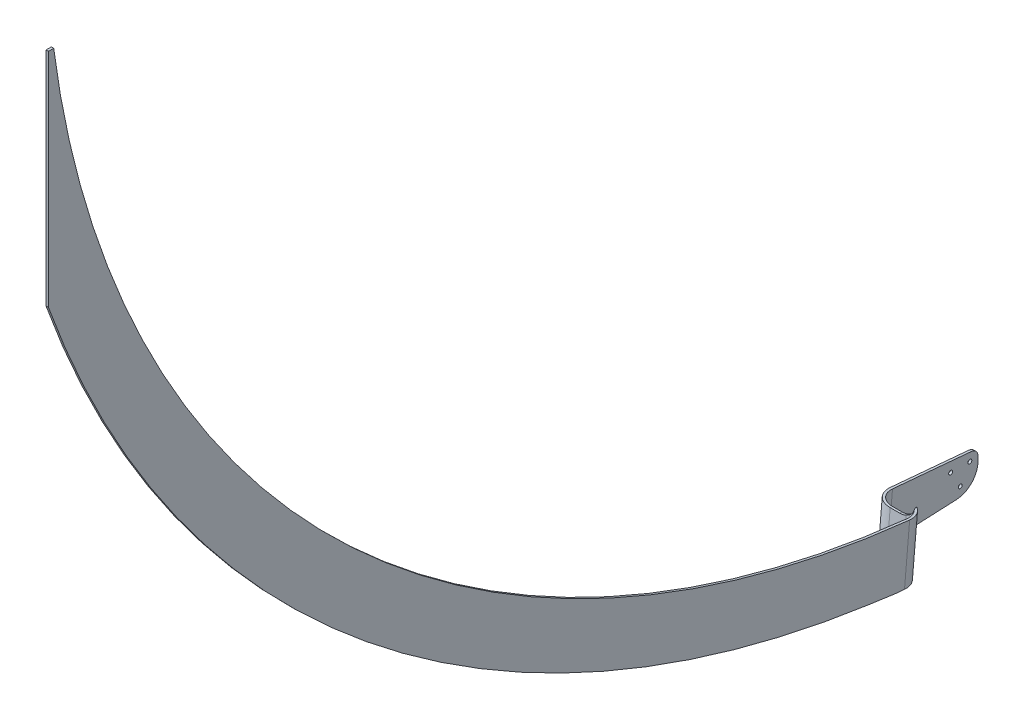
SolidWorks part; units mm, degrees
ref_plane "Front Plane" through (0, 0, 0) normal (1, 0, 0) x (0, 1, 0)
ref_plane "Top Plane" through (0, 0, 0) normal (0, 0, 1) x (0, 1, 0)
ref_plane "Right Plane" through (0, 0, 0) normal (0, 1, 0) x (-1, 0, 0)
sketch "sk Profile Rad Corner"
sketch_block_instance "Profile Rad Corner-1"
sketch_block "Profile Rad Corner"
sketch "Sketch2" plane through (0, 0, 0) normal (1, 0, 0) x (0, 1, 0)
  line L2 (2319.3675, 1853.7225) -> (1274.52, 1853.7225)
  line L3 (-80.9625, 498.24) -> (-80.9625, -463.1118)
  line L4 (2322.094, 1777.5225) -> (1274.52, 1777.5225)
  line L5 (-4.7625, 498.24) -> (-4.7625, -463.1118)
  line L6 (2319.3675, 1777.5225) -> (1274.52, 1777.5225)
  line L7 (-4.7625, 498.24) -> (-4.7625, -463.1118)
  line L8 (2319.3675, 1853.7225) -> (2319.3675, 1777.5225)
  line L9 (-4.7625, -463.1118) -> (-80.9625, -463.1118)
  arc A1 (1274.52, 1853.7225) -> (-80.9625, 498.24) centre (1274.52, 498.24) ccw
  arc A2 (1274.52, 1777.5225) -> (-4.7625, 498.24) centre (1274.52, 498.24) ccw
  arc A3 (1274.52, 1777.5225) -> (-4.7625, 498.24) centre (1274.52, 498.24) ccw
  dimension "D1" = 3.175
  dimension "D2" = 76.2
extrude "Boss-Extrude1" add sketch "Sketch2" along normal mid plane 3.175
sketch "Sketch3" plane through (0, 0, 0) normal (1, 0, 0) x (0, 1, 0)
  line L0 (-90.7135, 620.3852) -> (0.327, 612.24)
  line L1 (0.327, 612.24) -> (0.327, -654.8891)
  line L2 (0.327, -654.8891) -> (-90.7135, -654.8891)
  line L3 (-90.7135, -654.8891) -> (-90.7135, 620.3852)
  line L4 (-1.7425, 589.1085) -> (2.3966, 635.3715) construction
  line L5 (-63.1351, 758.0146) -> (-88.0045, 480.0461) construction
  arc A0 (1274.52, 1777.5225) -> (-4.7625, 498.24) centre (1274.52, 498.24) ccw construction
  arc A1 (1274.52, 1853.7225) -> (-80.9625, 498.24) centre (1274.52, 498.24) ccw construction
  point P7 (-75.5698, 619.0304)
  point P11 (0.327, 612.24)
  point P19 (-75.5698, 619.0304)
  dimension "D1" = 114
extrude "Cut-Extrude2" cut sketch "Sketch3" against normal through all both and the other way through all
ref_plane "Rib Tang 1" through (0, -129.9136, 11.6232) normal (0, -0.996, 0.0891) x (0, -0.0891, -0.996)
sketch "Sketch4" plane through (0, -129.9136, 11.6232) normal (0, -0.996, 0.0891) x (0, -0.0891, -0.996)
  line L24 (-677.4232, 1.5875) -> (-606.2482, 1.5875)
  line L25 (-606.2482, 1.5875) -> (-606.2482, -44.7675)
  line L26 (-584.0232, -66.9925) -> (-470.4232, -66.9925)
  line L27 (-677.4232, -1.5875) -> (-609.4232, -1.5875)
  line L28 (-609.4232, -1.5875) -> (-609.4232, -44.7675)
  line L29 (-584.0232, -70.1675) -> (-470.4232, -70.1675)
  line L30 (-677.4232, -1.5875) -> (-677.4232, 1.5875)
  line L31 (-470.4232, -66.9925) -> (-470.4232, -70.1675)
  line L32 (-609.8334, 1.5875) -> (-1959.9232, 1.5875) construction
  line L33 (-606.2482, 1.5875) -> (-606.2482, -66.9925) construction
  line L34 (-606.2482, -66.9925) -> (-470.4232, -66.9925) construction
  line L35 (-609.4232, -1.5875) -> (-609.4232, -70.1675) construction
  line L36 (-609.4232, -70.1675) -> (-470.4232, -70.1675) construction
  arc A12 (-606.2482, -44.7675) -> (-584.0232, -66.9925) centre (-584.0232, -44.7675) ccw
  arc A13 (-609.4232, -44.7675) -> (-584.0232, -70.1675) centre (-584.0232, -44.7675) ccw
  dimension "D1" = 3.175
  dimension "D6" = 25.4
  dimension "D5" = 22.225
  dimension "D3" = 207
  dimension "D4" = 68
  dimension "D2" = 68.58
extrude "Boss-Extrude2" add sketch "Sketch4" against normal blind 59
fillet "Fillet1" radius 22.225 1 edges at (-1.5875, -46.2237, 615.993)
fillet "Fillet2" radius 25.4 1 edges at (1.5875, -46.5067, 612.8306)
fillet "Fillet6" radius 12 1 edges at (-19.5621, -8.2388, 613.0064)
fillet "Fillet7" radius 22 1 edges at (-9.7343, -16.4903, 617.285)
sketch "Sketch5" plane through (0, 0, 0) normal (1, 0, 0) x (0, 1, 0)
  line L0 (-85.7484, 702.3647) -> (-66.0818, 698.9522)
  line L1 (-66.0818, 698.9522) -> (-77.7465, 615.6451)
  line L2 (-85.7484, 702.3647) -> (-77.7465, 615.6451)
  arc A0 (1274.52, 1853.7225) -> (-67.8672, 686.201) centre (1274.52, 498.24) ccw construction
extrude "Cut-Extrude3" cut sketch "Sketch5" against normal through all both and the other way through all
sketch "Sketch6" plane through (-66.9925, 0, 0) normal (1, 0, 0) x (0, 1, 0)
  point P0 (-38.9875, 485.7178)
  line B0 (-60.9845, 498.4178) -> (-38.9875, 511.1178) construction
  line B1 (-38.9875, 511.1178) -> (-38.9875, 485.7178) construction
  line B2 (-38.9875, 485.7178) -> (-60.9845, 498.4178) construction
  circle B3 centre (-60.9845, 498.4178) radius 2.5908
  circle B4 centre (-38.9875, 485.7178) radius 2.5908
  circle B5 centre (-38.9875, 511.1178) radius 2.5908
  line B6 (-49.986, 504.7678) -> (-46.3198, 498.4178) construction
sketch_block_instance "Blind Rivet holes-1"
sketch_block "Blind Rivet holes" parameters "D1"=5.1816, "D2"=5.1816, "D3"=5.1816, "D4"=60, "D5"=60, "D6"=25.4, "D7"=25.4, "D8"=25.4
extrude "Holes Tab 1" cut sketch "Sketch6" against normal through all both and the other way through all
sketch "Sketch7" plane through (-66.9925, 0, 0) normal (1, 0, 0) x (0, 1, 0)
  line L0 (-87.993, 480.1748) -> (-29.2277, 474.9171)
  line L1 (-29.2277, 474.9171) -> (-88.4634, 474.9171)
  line L2 (-87.993, 480.1748) -> (-77.8698, 593.3228) construction
  line L3 (-88.4634, 474.9171) -> (-87.993, 480.1748)
extrude "Boss-Extrude3" add sketch "Sketch7" against normal blind 3.175
fillet "Fillet9" radius 9.525 1 edges at (-68.58, -29.2277, 474.9171)
sketch "Sketch8" plane through (0, 0, 0) normal (1, 0, 0) x (0, 1, 0)
  line L0 (-77.8698, 593.3228) -> (-72.4634, 474.9171)
  line L1 (-77.8698, 593.3228) -> (-91.6494, 474.9171)
  line L2 (-91.6494, 474.9171) -> (-72.4634, 474.9171)
  line L3 (-88.4634, 474.9171) -> (-37.9386, 474.9171) construction
  dimension "D1" = 16
extrude "Cut-Extrude5" cut sketch "Sketch8" against normal through all both and the other way through all
fillet "Fillet11" radius 30 1 edges at (-68.58, -72.4634, 474.9171)
sketch "Sketch9" plane through (0, 0, 0) normal (1, 0, 0) x (0, 1, 0)
  line L0 (1249.434, 1778.2534) -> (1149.606, 1772.3908) construction
  line L1 (1193.7301, 1873.9118) -> (1201.753, 1737.2996)
  line L2 (1201.753, 1737.2996) -> (2399.2407, 1737.2996)
  line L3 (2399.2407, 1737.2996) -> (2399.2407, 1873.9118)
  line L4 (2399.2407, 1873.9118) -> (1193.7301, 1873.9118)
  line L5 (1145.1387, 1848.4597) -> (1244.9667, 1854.3224) construction
  arc A1 (1274.52, 1853.7225) -> (-80.9625, 498.24) centre (1274.52, 498.24) ccw construction
  arc A2 (1274.52, 1777.5225) -> (-4.7625, 498.24) centre (1274.52, 498.24) ccw construction
  point P9 (1199.52, 1775.3221)
  point P12 (1195.0527, 1851.391)
  dimension "D1" = 75
extrude "Cut-Extrude6" cut sketch "Sketch9" against normal through all both and the other way through all
ref_plane "Rib Tang 2" through (0, -104.2466, 1775.0863) normal (0, -0.0586, 0.9983) x (0, -0.9983, -0.0586)
sketch "Sketch11" plane through (0, -104.2466, 1775.0863) normal (0, -0.0586, 0.9983) x (0, -0.9983, -0.0586)
  line L0 (-1280.6049, -1.5875) -> (-1305.6049, -1.5875)
  line L1 (-1305.6049, -1.5875) -> (-1305.6049, -66.9925)
  line L2 (-1305.6049, -66.9925) -> (-1403.6049, -66.9925)
  line L3 (-1280.6049, 1.5875) -> (-1308.7799, 1.5875)
  line L4 (-1308.7799, 1.5875) -> (-1308.7799, -63.8175)
  line L5 (-1308.7799, -63.8175) -> (-1403.6049, -63.8175)
  line L6 (-1280.6049, 1.5875) -> (-1280.6049, -1.5875)
  line L7 (-1301.5379, -1.5875) -> (27.5209, -1.5875) construction
  line L8 (-1403.6049, -63.8175) -> (-1403.6049, -66.9925)
  dimension "D2" = 65.405
  dimension "D3" = 123
  dimension "D4" = 25
  dimension "D1" = 3.175
extrude "Boss-Extrude4" add sketch "Sketch11" against normal blind 54
sketch "Sketch12" plane through (0, 0, 0) normal (1, 0, 0) x (0, 1, 0)
  point P0 (1261.6422, 1811.7475)
  line B0 (1274.3422, 1833.7445) -> (1287.0422, 1811.7475) construction
  line B1 (1287.0422, 1811.7475) -> (1261.6422, 1811.7475) construction
  circle B2 centre (1261.6422, 1811.7475) radius 2.5908
  circle B3 centre (1287.0422, 1811.7475) radius 2.5908
  circle B4 centre (1274.3422, 1833.7445) radius 2.5908
  line B5 (1274.3422, 1811.7475) -> (1274.3422, 1819.0798) construction
sketch_block_instance "Blind Rivet holes-2"
extrude "Cut-Extrude7" cut sketch "Sketch12" against normal through all and the other way through all
sketch "Sketch13" plane through (0, 0, 0) normal (1, 0, 0) x (0, 1, 0)
  line L0 (1296.9441, 1857.3749) -> (1297.6195, 1845.8749)
  line L1 (1300.11, 1803.4678) -> (1296.9441, 1857.3749) construction
  line L2 (1297.6195, 1845.8749) -> (1202.2822, 1851.8156)
  line L3 (1202.2822, 1851.8156) -> (1296.9441, 1857.3749)
  dimension "D1" = 11.5
extrude "Cut-Extrude8" cut sketch "Sketch13" against normal through all
fillet "Fillet13" radius 30 1 edges at (-65.405, 1297.6195, 1845.8749)
fillet "Fillet14" radius 9.525 1 edges at (-65.405, 1300.11, 1803.4678)
fillet "Fillet15" radius 22.225 2 edges at (-1.5875, 1200.6956, 1824.6759) (-63.8175, 1203.8651, 1824.8621)
fillet "Fillet16" radius 25.4 2 edges at (1.5875, 1203.8651, 1824.8621) (-66.9925, 1200.6956, 1824.6759)
fillet "Fillet17" radius 20 1 edges at (-8.5243, 1198.2185, 1797.4839)
sketch "Sketch14" plane through (0, 0, 0) normal (1, 0, 0) x (0, 1, 0)
  line L0 (1274.52, 1774.3475) -> (760.4324, 1774.3475) construction
  line L1 (1055.8663, 1943.9281) -> (1055.8663, 1602.1857) construction
  line L2 (1109.5996, 1773.8475) -> (760.4324, 1773.8475)
  line L3 (760.4324, 1773.8475) -> (760.4324, 1889.5574)
  line L4 (760.4324, 1889.5574) -> (1361.5064, 1889.5574)
  line L6 (1274.52, 1773.8475) -> (760.4324, 1773.8475) construction
  line L9 (1109.5996, 1773.8475) -> (1109.5996, 1766.8475)
  line L10 (1109.5996, 1766.8475) -> (1361.5064, 1766.8475)
  line L11 (1361.5064, 1766.8475) -> (1361.5064, 1889.5574)
  arc A0 (1181.4008, 1774.1289) -> (2.4563, 633.9514) centre (1274.52, 498.24) ccw construction
  dimension "D2" = 7
  dimension "D1" = 0.5
extrude "Cut-Extrude9" cut sketch "Sketch14" against normal through all both and the other way through all
